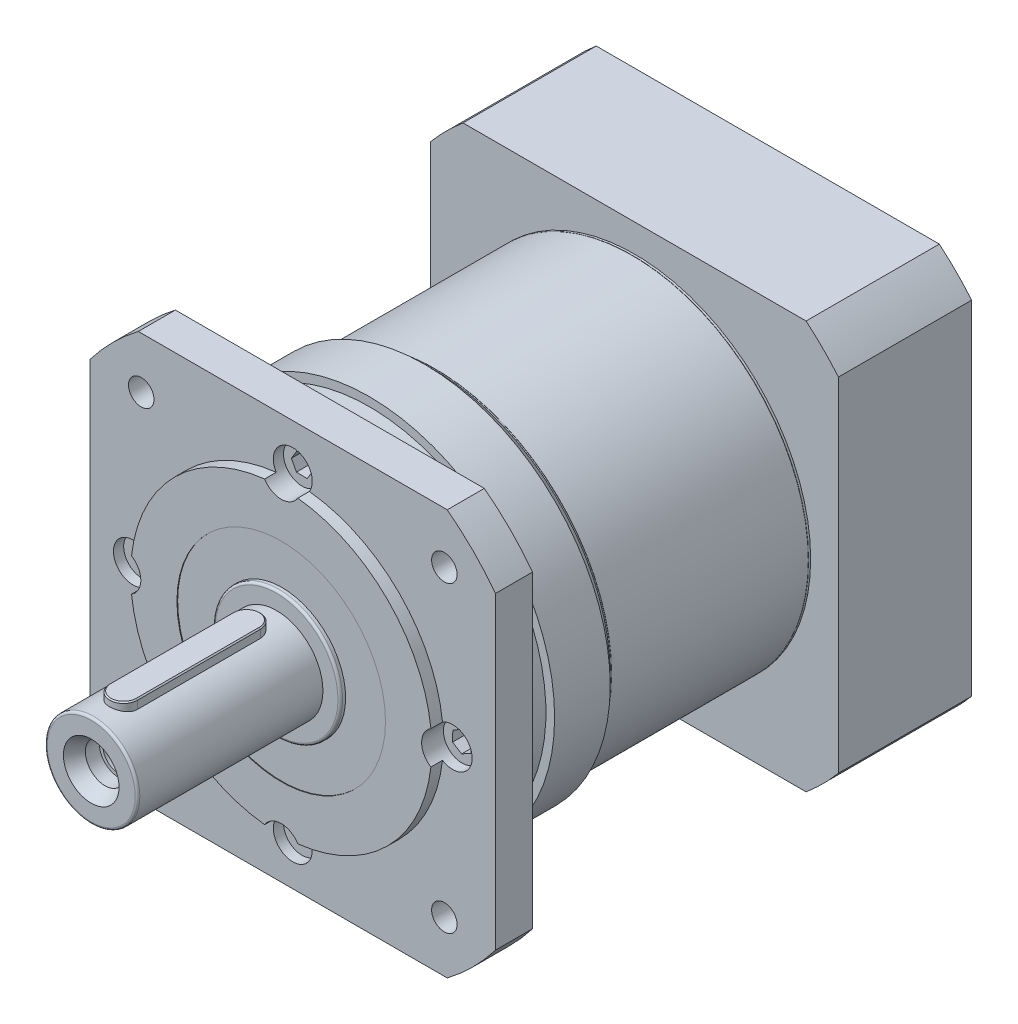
SolidWorks part; units mm, degrees
ref_plane "前视基准面" through (0, 0, 0) normal (0, 0, 1) x (1, 0, 0)
ref_plane "上视基准面" through (0, 0, 0) normal (0, 1, 0) x (1, 0, 0)
ref_plane "右视基准面" through (0, 0, 0) normal (1, 0, 0) x (0, 0, -1)
sketch "草图1" plane through (0, 0, 0) normal (0, 0, 1) x (1, 0, 0)
  circle A0 centre (0, 0) radius 80
extrude "凸台-拉伸1" add sketch "草图1" along normal blind 61.5
sketch "草图2" plane through (0, 0, 61.5) normal (0, 0, 1) x (1, 0, 0)
  circle A0 centre (0, 0) radius 65
extrude "凸台-拉伸2" add sketch "草图2" along normal blind 5
sketch "草图3" plane through (0, 0, 0) normal (0, 0, -1) x (-1, 0, 0)
  circle A0 centre (0, 0) radius 76
extrude "切除-拉伸1" cut sketch "草图3" against normal blind 0.5 flip side to cut
chamfer "倒角1" distance 4 angle 45 1 edges at (-80, 0, 0.5)
sketch "草图4" plane through (0, 0, 66.5) normal (0, 0, 1) x (1, 0, 0)
  line L0 (0, 0) -> (0, -69) construction
  circle A0 centre (0, 0) radius 69 construction
  circle A1 centre (0, -69) radius 8.4
extrude "切除-拉伸2" cut sketch "草图4" against normal blind 19
pattern_circular "阵列(圆周)1" count 4 over 360 about axis through (0, 0, 0) along (0, 0, 1) of "切除-拉伸2"
sketch "草图5" plane through (0, 0, 66.5) normal (0, 0, 1) x (1, 0, 0)
  circle A0 centre (0, 0) radius 27.5
extrude "凸台-拉伸3" add sketch "草图5" along normal blind 2
sketch "草图6" plane through (0, 0, 68.5) normal (0, 0, 1) x (1, 0, 0)
  circle A0 centre (0, 0) radius 20
extrude "凸台-拉伸4" add sketch "草图6" along normal blind 80
fillet "圆角1" radius 1 1 edges at (20, 0, 148.5)
fillet "圆角2" radius 1 1 edges at (27.5, 0, 68.5)
sketch "草图7" plane through (0, 0, 66.5) normal (0, 0, 1) x (1, 0, 0)
  circle A0 centre (0, 0) radius 45
  circle A1 centre (0, 0) radius 27.5
extrude "切除-拉伸3" cut sketch "草图7" against normal blind 0.3
ref_plane "基准面1" through (0, 0, -0.1) normal (0, 0, -1) x (-1, 0, 0)
sketch "草图8" plane through (0, 0, 61.5) normal (0, 0, 1) x (1, 0, 0)
  line L0 (0, 0) -> (0, 72.5)
  line L1 (0, 0) -> (-51.2652, 51.2652)
  circle A0 centre (0, 0) radius 72.5
  dimension "D1" = 45
sketch "草图10" plane through (0, 0, -0.1) normal (0, 0, -1) x (-1, 0, 0)
  circle A0 centre (0, 0) radius 76
extrude "凸台-拉伸5" add sketch "草图10" along normal blind 84.9 separate body
ref_plane "基准面2" through (0, 0, -85.1) normal (0, 0, -1) x (-1, 0, 0)
sketch "草图11" plane through (0, 0, -85.1) normal (0, 0, -1) x (-1, 0, 0)
  circle A0 centre (0, 0) radius 76
extrude "凸台-拉伸6" add sketch "草图11" along normal blind 0.9 separate body
sketch "草图12" plane through (0, 0, -86) normal (0, 0, -1) x (-1, 0, 0)
  line L1 (-74.0338, 88) -> (74.0338, 88)
  line L2 (-88, 74.0338) -> (-88, -74.0338)
  line L3 (-74.0338, -88) -> (74.0338, -88)
  line L4 (88, 74.0338) -> (88, -74.0338)
  arc A0 (-74.0338, 88) -> (-88, 74.0338) centre (0, 0) ccw
  arc A1 (-88, -74.0338) -> (-74.0338, -88) centre (0, 0) ccw
  arc A2 (74.0338, -88) -> (88, -74.0338) centre (0, 0) ccw
  arc A3 (88, 74.0338) -> (74.0338, 88) centre (0, 0) ccw
  dimension "D1" = 88
  dimension "D3" = 88
extrude "凸台-拉伸7" add sketch "草图12" along normal blind 57.5
sketch "草图13" plane through (0, 0, -143.5) normal (0, 0, -1) x (-1, 0, 0)
  circle A0 centre (0, 0) radius 57.15
extrude "切除-拉伸4" cut sketch "草图13" against normal blind 7
sketch "草图14" plane through (0, 0, -136.5) normal (0, 0, -1) x (-1, 0, 0)
  circle A0 centre (0, 0) radius 55
extrude "切除-拉伸5" cut sketch "草图14" against normal blind 25
sketch "草图15" plane through (0, 0, -111.5) normal (0, 0, -1) x (-1, 0, 0)
  circle A0 centre (0, 0) radius 50
extrude "切除-拉伸6" cut sketch "草图15" against normal blind 30.5
sketch "草图16" plane through (0, 0, -143.5) normal (0, 0, -1) x (-1, 0, 0)
  line L0 (0, 0) -> (0, -67.5) construction
  circle A0 centre (0, 0) radius 67.5 construction
  circle A1 centre (0, -67.5) radius 7
extrude "切除-拉伸7" cut sketch "草图16" against normal blind 11
pattern_circular "阵列(圆周)3" count 4 over 360 about axis through (0, 0, 0) along (0, 0, 1) of "切除-拉伸7"
sketch "草图17" plane through (0, 0, -143.5) normal (0, 0, -1) x (-1, 0, 0)
  line L0 (0, 0) -> (-81.3173, 81.3173)
  circle A0 centre (0, 0) radius 100
  arc A1 (-74.0338, 88) -> (-88, 74.0338) centre (0, 0) ccw construction
hole_wizard "M8 螺纹孔1" positions "3D草图2" profile "草图18" tap size "M8" standard "GB"
sketch3d "3D草图2"
  line L0 (0, 0, -143.5) -> (81.3173, 81.3173, -143.5) construction
  circle A0 centre (0, 0, -143.5) radius 100 construction
  point P0 (70.7107, 70.7107, -143.5)
  point P6 (0, 0, -243.5)
sketch "草图18" plane through (70.7107, 70.7107, -143.5) normal (1, 0, 0) x (0, 1, 0)
  line L0 (0, 0) -> (0, 31.0429)
  line L1 (0, 31.0429) -> (3.4, 29)
  line L2 (3.4, 29) -> (3.4, 0)
  line L5 (3.4, 0) -> (0, 0)
  line L10 (0, 31.0429) -> (-3.4, 29) construction
  line L11 (0, -6.35) -> (0, 107.95) construction
  dimension "螺纹孔钻头直径" = 6.8
  dimension "螺纹孔钻头深度" = 29
  dimension "导头角度" = 118
pattern_circular "阵列(圆周)4" count 4 over 360 about axis through (0, 0, 0) along (0, 0, 1) of "M8 螺纹孔1"
sketch "草图19" plane through (0, 0, 47.5) normal (0, 0, 1) x (1, 0, 0)
  line L1 (2.4055, 72.943) -> (-2.212, 73.0547)
  line L2 (-2.212, 73.0547) -> (-4.6175, 69.1117)
  line L3 (-4.6175, 69.1117) -> (-2.4055, 65.057)
  line L4 (-2.4055, 65.057) -> (2.212, 64.9453)
  line L5 (2.212, 64.9453) -> (4.6175, 68.8883)
  line L6 (4.6175, 68.8883) -> (2.4055, 72.943)
  circle A0 centre (0, 69) radius 8
  circle A1 centre (0, 69) radius 4 construction
  dimension "D1" = 8
extrude "凸台-拉伸8" add sketch "草图19" along normal blind 10
pattern_circular "阵列(圆周)5" count 4 over 360 about axis through (0, 0, 0) along (0, 0, 1) of "凸台-拉伸8"
sketch "草图20" plane through (0, 0, -132.5) normal (0, 0, -1) x (-1, 0, 0)
  line L1 (1.7033, 70.5164) -> (-1.7607, 70.4833)
  line L2 (-1.7607, 70.4833) -> (-3.4639, 67.4669)
  line L3 (-3.4639, 67.4669) -> (-1.7033, 64.4836)
  line L4 (-1.7033, 64.4836) -> (1.7607, 64.5167)
  line L5 (1.7607, 64.5167) -> (3.4639, 67.5331)
  line L6 (3.4639, 67.5331) -> (1.7033, 70.5164)
  circle A0 centre (0, 67.5) radius 6.5
  circle A1 centre (0, 67.5) radius 3 construction
  dimension "D1" = 6
extrude "凸台-拉伸9" add sketch "草图20" along normal blind 8
pattern_circular "阵列(圆周)6" count 4 over 360 about axis through (0, 0, 0) along (0, 0, 1) of "凸台-拉伸9"
ref_plane "基准面3" through (0, 0, -110.5) normal (0, 0, -1) x (-1, 0, 0)
sketch "草图21" plane through (0, 0, -110.5) normal (0, 0, -1) x (-1, 0, 0)
  circle A0 centre (0, 0) radius 37.5
extrude "凸台-拉伸10" add sketch "草图21" against normal up to surface (29.5 mm away)
chamfer "倒角2" distance 1.5 angle 45 1 edges at (-37.5, 0, -110.5)
sketch "草图22" plane through (0, 0, -143.5) normal (0, 0, -1) x (-1, 0, 0)
  circle A0 centre (0, 0) radius 17.5
extrude "切除-拉伸8" cut sketch "草图22" against normal blind 86
sketch "草图23" plane through (0, 0, -110.5) normal (0, 0, -1) x (-1, 0, 0)
  line L1 (-43.0001, 0.5) -> (42.7283, 0.5)
  line L2 (-43.0001, 0.5) -> (-43.0001, -0.5)
  line L3 (-43.0001, -0.5) -> (42.7283, -0.5)
  line L4 (42.7283, 0.5) -> (42.7283, -0.5)
  dimension "D1" = 0.5
  dimension "D2" = 1
extrude "切除-拉伸9" cut sketch "草图23" against normal up to surface (29.5 mm away)
sketch "草图24" plane through (0, 0, 0) normal (0, 1, 0) x (1, 0, 0)
  line L0 (-6, -134.5) -> (-6, -81.5)
  line L1 (6, -134.5) -> (6, -81.5)
  line L2 (-19, -148.5) -> (19, -148.5) construction
  arc A0 (-6, -134.5) -> (6, -134.5) centre (0, -134.5) ccw
  arc A1 (6, -81.5) -> (-6, -81.5) centre (0, -81.5) ccw
  dimension "D1" = 14
  dimension "D2" = 53
extrude "凸台-拉伸11" add sketch "草图24" along normal blind 23
chamfer "倒角3" distance 0.5 angle 45 4 edges at (6, 23, 108) (0, 23, 75.5) (0, 23, 140.5) (-6, 23, 108)
sketch "草图25" plane through (0, 0, 61.5) normal (0, 0, 1) x (1, 0, 0)
  line L1 (-66.6615, 87.5) -> (66.6615, 87.5)
  line L2 (-87.5, 66.6615) -> (-87.5, -66.6615)
  line L3 (-66.6615, -87.5) -> (66.6615, -87.5)
  line L4 (87.5, 66.6615) -> (87.5, -66.6615)
  arc A0 (-66.6615, 87.5) -> (-87.5, 66.6615) centre (0, 0) ccw
  arc A1 (-87.5, -66.6615) -> (-66.6615, -87.5) centre (0, 0) ccw
  arc A2 (66.6615, -87.5) -> (87.5, -66.6615) centre (0, 0) ccw
  arc A3 (87.5, 66.6615) -> (66.6615, 87.5) centre (0, 0) ccw
  arc A4 (-4.4577, 76.1196) -> (-76.1196, 4.4577) centre (0, 0) ccw
  arc A5 (7.1583, 64.6046) -> (-7.1583, 64.6046) centre (0, 69) ccw construction
  arc A6 (4.4577, 76.1196) -> (-4.4577, 76.1196) centre (0, 69) ccw
  arc A7 (64.6046, -7.1583) -> (64.6046, 7.1583) centre (69, 0) ccw construction
  circle A8 centre (0, -69) radius 8.4 construction
  arc A9 (-64.6046, 7.1583) -> (-64.6046, -7.1583) centre (-69, 0) ccw construction
  arc A10 (76.1196, -4.4577) -> (76.1196, 4.4577) centre (69, 0) ccw
  arc A11 (-4.4577, -76.1196) -> (4.4577, -76.1196) centre (0, -69) ccw
  arc A12 (-76.1196, 4.4577) -> (-76.1196, -4.4577) centre (-69, 0) ccw
  arc A13 (-76.1196, -4.4577) -> (-4.4577, -76.1196) centre (0, 0) ccw
  arc A14 (4.4577, -76.1196) -> (76.1196, -4.4577) centre (0, 0) ccw
  arc A15 (76.1196, 4.4577) -> (4.4577, 76.1196) centre (0, 0) ccw
  dimension "D1" = 87.5
  dimension "D3" = 87.5
extrude "凸台-拉伸12" add sketch "草图25" against normal blind 16
sketch "草图26" plane through (0, 0, 45.5) normal (0, 0, -1) x (-1, 0, 0)
  circle A0 centre (0, 0) radius 76.25
extrude "切除-拉伸10" cut sketch "草图26" along normal blind 17 flip side to cut
sketch "草图28" plane through (0, 0, 61.5) normal (0, 0, 1) x (1, 0, 0)
  line L0 (0, 0) -> (-77.7817, 77.7817) construction
  circle A0 centre (0, 0) radius 92.5 construction
  arc A1 (-66.6615, 87.5) -> (-87.5, 66.6615) centre (0, 0) ccw construction
  circle A2 centre (-65.4074, 65.4074) radius 5.5
extrude "切除-拉伸11" cut sketch "草图28" against normal blind 17
pattern_circular "阵列(圆周)7" count 4 over 360 about axis through (0, 0, 0) along (0, 0, 1) of "切除-拉伸11"
sketch "草图29" plane through (0, 0, 148.5) normal (0, 0, 1) x (1, 0, 0)
  circle A0 centre (0, 0) radius 8.5
extrude "切除-拉伸12" cut sketch "草图29" against normal blind 12
sketch "草图30" plane through (0, 0, 148.5) normal (0, 0, 1) x (1, 0, 0)
  circle A0 centre (0, 0) radius 12
ref_plane "基准面4" through (0, 0, 142.5) normal (0, 0, 1) x (1, 0, 0)
sketch "草图31" plane through (0, 0, 142.5) normal (0, 0, 1) x (1, 0, 0)
  circle A0 centre (0, 0) radius 8.5 construction
  circle A1 centre (0, 0) radius 8.5
loft "切除-放样1" cut profiles "草图30", "草图31"
hole_wizard "M16 螺纹孔1" positions "3D草图3" profile "草图32" tap size "M16" standard "GB"
sketch3d "3D草图3"
  line L0 (0, 0, 136.5) -> (0, 0, 142.5) construction
  point P0 (0, 0, 136.5)
sketch "草图32" plane through (0, 0, 136.5) normal (1, 0, 0) x (0, -1, 0)
  line L0 (0, 0) -> (0, 38.206)
  line L1 (0, 38.206) -> (7, 34)
  line L2 (7, 34) -> (7, 0)
  line L5 (7, 0) -> (0, 0)
  line L10 (0, 38.206) -> (-7, 34) construction
  line L11 (0, -6.35) -> (0, 107.95) construction
  dimension "螺纹孔钻头直径" = 14
  dimension "螺纹孔钻头深度" = 34
  dimension "导头角度" = 118
